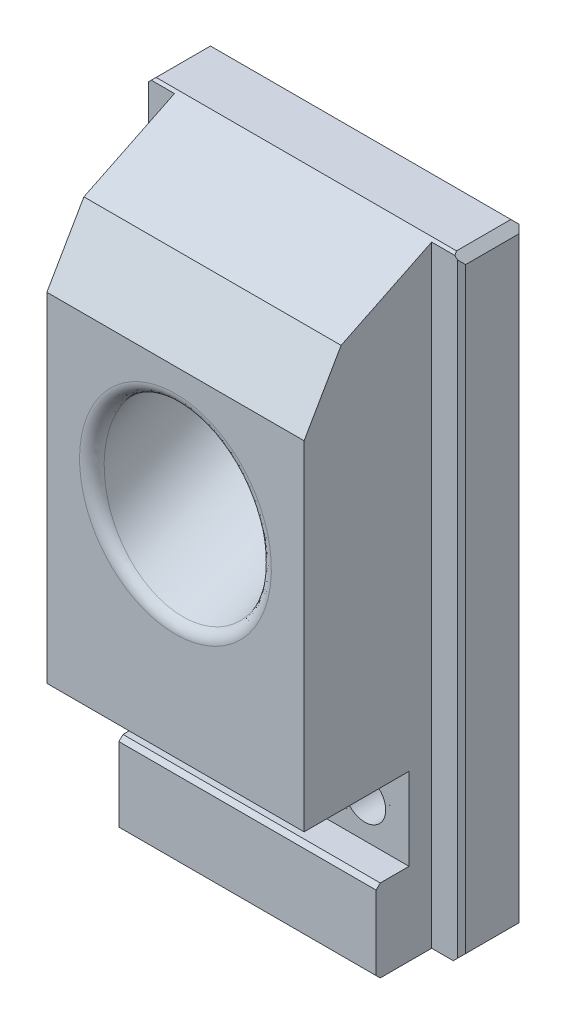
SolidWorks part; units mm, degrees
ref_plane "Front Plane" through (0, 0, 0) normal (0, 0, 1) x (1, 0, 0)
ref_plane "Top Plane" through (0, 0, 0) normal (0, 1, 0) x (1, 0, 0)
ref_plane "Right Plane" through (0, 0, 0) normal (1, 0, 0) x (0, 0, -1)
imported_body "Imported1"
sketch "Sketch1" plane through (0, 0, -11.684) normal (0, 0, -1) x (-1, 0, 0)
  line L0 (-9.779, 6.2865) -> (-9.779, 37.338) construction
  line L1 (-9.779, 6.5405) -> (-6.1971, 6.5405)
  line L2 (-9.779, 6.5405) -> (-9.779, 3.3655)
  line L3 (-9.779, 3.3655) -> (9.779, 3.3655)
  line L4 (9.779, 6.5405) -> (9.779, 3.3655)
  line L5 (9.779, 3.6195) -> (9.779, 0.508) construction
  line L6 (-9.525, 3.3655) -> (9.525, 3.3655) construction
  line L7 (-3.8507, 6.5405) -> (3.8507, 6.5405) construction
  line L8 (-4.2169, 6.5405) -> (4.2169, 6.5405)
  line L9 (6.1971, 6.5405) -> (9.779, 6.5405)
  arc A0 (-6.1971, 6.5405) -> (-4.2169, 6.5405) centre (-5.207, 7.366) ccw construction
  arc A1 (-6.1971, 6.5405) -> (-4.2169, 6.5405) centre (-5.207, 7.366) ccw
  arc A2 (4.2169, 6.5405) -> (6.1971, 6.5405) centre (5.207, 7.366) ccw construction
  arc A3 (4.2169, 6.5405) -> (6.1971, 6.5405) centre (5.207, 7.366) ccw
extrude "Boss-Extrude1" add sketch "Sketch1" against normal up to vertex
sketch "Sketch2" plane through (0, 3.3655, 0) normal (0, -1, 0) x (1, 0, 0)
  line L3 (9.779, -11.684) -> (9.779, -11.43)
  line L4 (9.779, -11.43) -> (9.525, -11.684)
  line L5 (9.525, -11.684) -> (9.779, -11.684)
  line L6 (9.779, -11.684) -> (9.779, -11.43)
  line L7 (9.779, -11.43) -> (9.525, -11.684)
  line L8 (9.525, -11.684) -> (9.779, -11.684)
  line L9 (-9.779, -11.684) -> (-9.525, -11.684)
  line L10 (-9.525, -11.684) -> (-9.779, -11.43)
  line L11 (-9.779, -11.43) -> (-9.779, -11.684)
  line L12 (-9.779, -11.684) -> (-9.525, -11.684)
  line L13 (-9.525, -11.684) -> (-9.779, -11.43)
  line L14 (-9.779, -11.43) -> (-9.779, -11.684)
  dimension "D1" = 0
  dimension "D2" = 0
extrude "Cut-Extrude1" cut sketch "Sketch2" against normal blind 3.175
